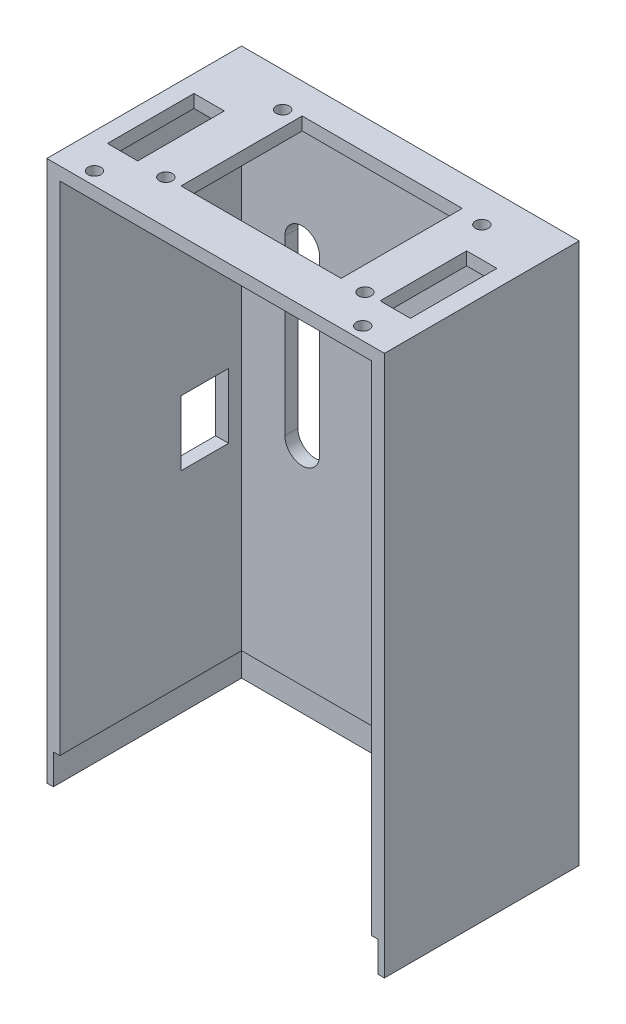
SolidWorks part; units mm, degrees
ref_plane "Front Plane" through (0, 0, 0) normal (0, 0, 1) x (1, 0, 0)
ref_plane "Top Plane" through (0, 0, 0) normal (0, 1, 0) x (1, 0, 0)
ref_plane "Right Plane" through (0, 0, 0) normal (1, 0, 0) x (0, 0, -1)
sketch "Sketch2" plane through (0, 0, 0) normal (0, 0, 1) x (1, 0, 0)
  line L1 (-39, 125) -> (39, 125)
  line L2 (-39, 125) -> (-39, -125)
  line L3 (-39, -125) -> (39, -125)
  line L4 (39, 125) -> (39, -125)
  line L5 (-39, 125) -> (39, -125) construction
  line L6 (-39, -125) -> (39, 125) construction
  point P0 (0, 0)
  dimension "D1" = 250
  dimension "D2" = 78
extrude "Boss-Extrude1" add sketch "Sketch2" along normal blind 3
sketch "Sketch3" plane through (0, 0, 3) normal (0, 0, 1) x (1, 0, 0)
  line L8 (36, -122) -> (36, 122)
  line L9 (36, 122) -> (-36, 122)
  line L10 (-36, 122) -> (-36, -122)
  line L11 (-36, -122) -> (36, -122)
  line L12 (36, -122) -> (36, 122)
  line L13 (36, 122) -> (-36, 122)
  line L14 (-36, 122) -> (-36, -122)
  line L15 (-36, -122) -> (36, -122)
  line L16 (-39, 125) -> (-39, -125)
  line L17 (-39, -125) -> (39, -125)
  line L18 (39, -125) -> (39, 125)
  line L19 (39, 125) -> (-39, 125)
  dimension "D1" = 3
  dimension "D2" = 3
extrude "Boss-Extrude2" add sketch "Sketch3" along normal blind 42
sketch "Sketch4" plane through (0, -125, 0) normal (0, -1, 0) x (1, 0, 0)
  line L5 (-16.5, 7) -> (-16.5, 19)
  line L6 (-16.5, 19) -> (-4.5, 19)
  line L7 (-4.5, 19) -> (-4.5, 7)
  line L9 (24, 7) -> (24, 18)
  line L10 (24, 18) -> (14.5, 18)
  line L11 (14.5, 18) -> (14.5, 7)
  line L13 (14.5, 7) -> (24, 7)
  line L14 (-16.5, 7) -> (-4.5, 7)
  line L15 (39, 45) -> (39, 0) construction
  line L16 (-39, 45) -> (39, 45) construction
  dimension "D1" = 26
  dimension "D2" = 12
  dimension "D3" = 12
  dimension "D4" = 15
  dimension "D5" = 19
  dimension "D7" = 11
  dimension "D8" = 9.5
extrude "Cut-Extrude3" cut sketch "Sketch4" against normal blind 7
sketch "Sketch6" plane through (-39, 0, 0) normal (-1, 0, 0) x (0, 0, 1)
  line L0 (45, 125) -> (0, 125) construction
  line L1 (0, 125) -> (0, -125) construction
  line L3 (6, 65) -> (17, 65)
  line L4 (6, 65) -> (6, 50)
  line L6 (6, 50) -> (17, 50)
  line L7 (17, 65) -> (17, 50)
  dimension "D1" = 60
  dimension "D2" = 15
  dimension "D3" = 11
  dimension "D4" = 6
extrude "Cut-Extrude4" cut sketch "Sketch6" against normal blind 6
sketch "Sketch9" plane through (0, -125, 0) normal (0, -1, 0) x (1, 0, 0)
  line L0 (-39, 45) -> (-39, 0) construction
  line L1 (39, 45) -> (39, 0) construction
  line L2 (-39, 45) -> (39, 45) construction
  circle A0 centre (-31, 42) radius 1.5
  circle A1 centre (31, 42) radius 1.5
  dimension "D3" = 3
  dimension "D4" = 3
  dimension "D1" = 8
  dimension "8" = 8
  dimension "D2" = 3
extrude "Cut-Extrude6" cut sketch "Sketch9" against normal through all
sketch "Sketch14" plane through (0, 0, 0) normal (0, 0, -1) x (-1, 0, 0)
  line L0 (-39, 125) -> (39, 125) construction
  line L4 (22, 95) -> (22, 55) construction
  line L5 (26, 95) -> (26, 55)
  line L6 (18, 95) -> (18, 55)
  line L7 (-22, 95) -> (-22, 55) construction
  line L8 (-18, 95) -> (-18, 55)
  line L9 (-26, 95) -> (-26, 55)
  line L10 (22, -35) -> (22, -75) construction
  line L11 (26, -35) -> (26, -75)
  line L12 (18, -35) -> (18, -75)
  line L13 (-22, -35) -> (-22, -75) construction
  line L14 (-18, -35) -> (-18, -75)
  line L15 (-26, -35) -> (-26, -75)
  line L16 (39, -125) -> (-39, -125) construction
  arc A0 (26, 95) -> (18, 95) centre (22, 95) ccw
  arc A1 (18, 55) -> (26, 55) centre (22, 55) ccw
  arc A2 (-18, 95) -> (-26, 95) centre (-22, 95) ccw
  arc A3 (-26, 55) -> (-18, 55) centre (-22, 55) ccw
  arc A4 (26, -35) -> (18, -35) centre (22, -35) ccw
  arc A5 (18, -75) -> (26, -75) centre (22, -75) ccw
  arc A6 (-18, -35) -> (-26, -35) centre (-22, -35) ccw
  arc A7 (-26, -75) -> (-18, -75) centre (-22, -75) ccw
  point P10 (22, 75)
  point P15 (-22, 75)
  point P22 (22, -55)
  point P29 (-22, -55)
  dimension "D4" = 4
  dimension "D1" = 30
  dimension "D3" = 40
  dimension "D5" = 50
extrude "Cut-Extrude8" cut sketch "Sketch14" against normal through all
sketch "Sketch16" plane through (0, 0, 0) normal (0, 0, -1) x (-1, 0, 0)
  line L0 (30, 160.4835) -> (30, -164.8694) construction
  line L1 (-30, 219.4493) -> (-30, -244.1456) construction
  line L2 (39, 125) -> (39, -125) construction
  line L3 (-39, 125) -> (39, 125) construction
  line L4 (39, -125) -> (-39, -125) construction
  line L5 (-39, -125) -> (-39, 125) construction
  circle A0 centre (30, 115) radius 1.5
  circle A1 centre (-30, 115) radius 1.5
  circle A2 centre (30, -114) radius 1.5
  circle A3 centre (-30, -114) radius 1.5
  dimension "D3" = 3
  dimension "D4" = 10
  dimension "D7" = 11
  dimension "D1" = 9
  dimension "D2" = 9
  dimension "D5" = 10
  dimension "D6" = 11
extrude "Cut-Extrude9" cut sketch "Sketch16" against normal through all
sketch "Sketch19" plane through (0, 125, 0) normal (0, 1, 0) x (1, 0, 0)
  line L0 (39, -45) -> (-39, -45) construction
  line L1 (39, 0) -> (-39, 0) construction
  line L9 (-18, -35) -> (-18, -7)
  line L10 (-18, -7) -> (19, -7)
  line L11 (19, -7) -> (19, -35)
  line L12 (19, -35) -> (-18, -35)
  dimension "D1" = 10
  dimension "D2" = 7
  dimension "D3" = 37
extrude "Cut-Extrude11" cut sketch "Sketch19" against normal blind 15
sketch "Sketch25" plane through (0, 125, 0) normal (0, 1, 0) x (1, 0, 0)
  line L0 (0, 0) -> (0, -50000) construction
  line L1 (-0.5425, -25) -> (49999.4575, -25) construction
  line L2 (-39, -45) -> (-39, 0) construction
  line L3 (-35, -35) -> (-28, -35)
  line L4 (-35, -35) -> (-35, -15)
  line L5 (-35, -15) -> (-28, -15)
  line L6 (-28, -35) -> (-28, -15)
  line L7 (-35, -35) -> (-28, -15) construction
  line L8 (-35, -15) -> (-28, -35) construction
  line L9 (28, -15) -> (35, -15)
  line L10 (28, -15) -> (28, -35)
  line L11 (28, -35) -> (35, -35)
  line L12 (35, -15) -> (35, -35)
  line L13 (28, -15) -> (35, -35) construction
  line L14 (28, -35) -> (35, -15) construction
  line L15 (39, 0) -> (-39, 0) construction
  line L16 (39, -45) -> (39, 0) construction
  point P5 (-31.5, -25)
  point P10 (31.5, -25)
  dimension "D1" = 7
  dimension "D2" = 20
  dimension "D3" = 4
  dimension "D4" = 4
  dimension "D5" = 7
  dimension "D6" = 20
  dimension "D7" = 15
extrude "Cut-Extrude16" cut sketch "Sketch25" against normal blind 4
sketch "Sketch27" plane through (0, 125, 0) normal (0, 1, 0) x (1, 0, 0)
  circle A0 centre (-21.5044, -8) radius 1.5
  circle A1 centre (24.5044, -8) radius 1.5
  circle A2 centre (-21.5044, -35) radius 1.5
  circle A3 centre (24.5044, -35) radius 1.5
extrude "Cut-Extrude17" cut sketch "Sketch27" against normal blind 10
sketch "Sketch28" plane through (0, 0, 3) normal (0, 0, 1) x (1, 0, 0)
  line L0 (-39, -125) -> (-39, 0)
  line L1 (-39, 125) -> (-39, -125) construction
  line L2 (-39, 0) -> (-36, 0)
  line L3 (-36, 122) -> (-36, -122) construction
  line L4 (-36, 0) -> (-36, -9.0545)
  line L5 (-36, 122) -> (-36, -122) construction
  line L6 (-36, -9.0545) -> (36, -9.0545)
  line L7 (36, -122) -> (36, 122) construction
  line L8 (36, -9.0545) -> (36, 0)
  line L9 (36, 0) -> (39, 0)
  line L10 (39, -125) -> (39, 125) construction
  line L11 (39, 0) -> (39, -125)
  line L12 (39, -125) -> (-39, -125)
  point P5 (0, 0)
  dimension "D1" = 250
  dimension "D2" = 125
  dimension "D3" = 125
extrude "Cut-Extrude19" cut sketch "Sketch28" along normal through all
sketch "Sketch29" plane through (0, 0, 3) normal (0, 0, 1) x (1, 0, 0)
  line L0 (-39, -125) -> (-39, 0)
  line L1 (39, -125) -> (-39, -125)
  line L2 (39, 0) -> (39, -125)
  line L3 (39, 0) -> (-39, 0)
extrude "Cut-Extrude20" cut sketch "Sketch29" against normal through all
sketch "Sketch30" plane through (0, 0, 3) normal (0, 0, 1) x (1, 0, 0)
  line L0 (-36, 0) -> (-36, 7)
  line L1 (-36, 122) -> (-36, 0) construction
  line L2 (-36, 7) -> (36, 7)
  line L3 (36, 0) -> (36, 122) construction
  line L4 (36, 7) -> (36, 0)
  line L5 (36, 0) -> (-36, 0)
  dimension "D1" = 7
extrude "Cut-Extrude21" cut sketch "Sketch30" against normal blind 1.5
sketch "Sketch31" plane through (0, 0, 45) normal (0, 0, 1) x (1, 0, 0)
  line L0 (-37.5, 0) -> (-37.5, 7)
  line L1 (-36, 0) -> (-39, 0) construction
  line L2 (-37.5, 7) -> (-36, 7)
  line L3 (-36, 122) -> (-36, 0) construction
  line L4 (-36, 7) -> (-36, 0) construction
  line L5 (-36, 7) -> (-36, 0)
  line L6 (-36, 0) -> (-37.5, 0)
  line L7 (36, 0) -> (36, 7)
  line L8 (36, 0) -> (36, 122) construction
  line L9 (36, 7) -> (37.5, 7)
  line L10 (37.5, 7) -> (37.5, 0)
  line L11 (39, 0) -> (36, 0) construction
  line L12 (37.5, 0) -> (36, 0)
  dimension "D1" = 7
  dimension "D2" = 7
extrude "Cut-Extrude22" cut sketch "Sketch31" against normal blind 43.5
